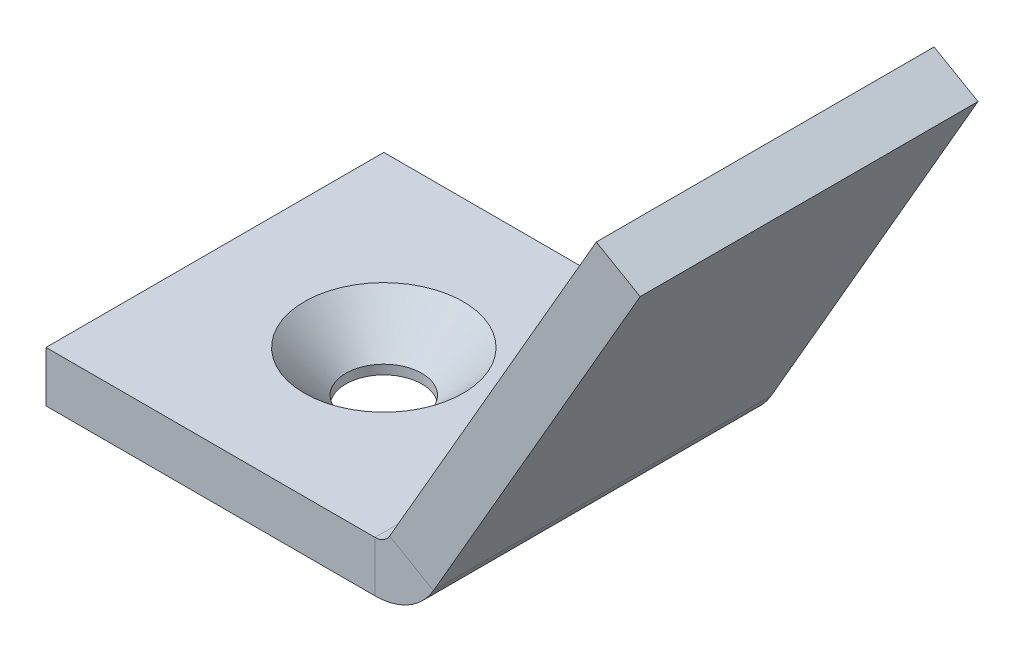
SolidWorks part; units mm, degrees
ref_plane "Front Plane" through (0, 0, 0) normal (0, 0, 1) x (1, 0, 0)
ref_plane "Top Plane" through (0, 0, 0) normal (0, 1, 0) x (1, 0, 0)
ref_plane "Right Plane" through (0, 0, 0) normal (1, 0, 0) x (0, 0, -1)
sketch "Sketch1" plane through (0, 0, 0) normal (0, 1, 0) x (1, 0, 0)
  line L1 (0, 0) -> (45, 0)
  line L2 (0, 0) -> (0, 20)
  line L3 (0, 20) -> (45, 20)
  line L4 (45, 0) -> (45, 20)
  dimension "D1" = 20
  dimension "D2" = 45
sheet metal parameters "Sheet-Metal1" thickness 3 parameters "D1"=1
base flange "Base-Flange1" sketch "Sketch1" thickness 3 reverse thickness direction yes parameters "D1"=1
sketch "Sketch3" plane through (0, 3, 0) normal (0, 1, 0) x (1, 0, 0)
  line L0 (45, 10) -> (0, 10) construction
  line L1 (45, 0) -> (45, 20) construction
  line L2 (0, 20) -> (0, 0) construction
  point P6 (10, 10)
  dimension "D1" = 10
hole_wizard "CSK for M4 Countersunk Flat Head Screw1" positions "3DSketch1" profile "Sketch4" countersink size "M4" standard "ISO"
sketch3d "3DSketch1"
  point P0 (10, 3, -10)
sketch "Sketch4" plane through (10, 3, -10) normal (1, 0, 0) x (0, 0, 1)
  line L0 (0, 0) -> (0, 3)
  line L1 (0, 3) -> (2.25, 3)
  line L2 (2.25, 3) -> (2.25, 2.45)
  line L3 (2.25, 2.45) -> (4.7, 0)
  line L5 (4.7, 0) -> (0, 0)
  line L6 (-2.25, 2.45) -> (-4.7, 0) construction
  line L11 (0, -6.35) -> (0, 107.95) construction
  dimension "Thru Hole Dia." = 4.5
  dimension "Thru Hole Depth" = 3
  dimension "Near C'Sink Dia." = 9.4
  dimension "Near C'Sink Angle" = 90
sketch "Sketch5" plane through (0, 3, 0) normal (0, 1, 0) x (1, 0, 0)
  line L0 (20, 20) -> (20, 0)
  line L3 (45, 20) -> (0, 20) construction
  line L4 (0, 0) -> (45, 0) construction
  circle A1 centre (10, 10) radius 4.7 construction
  dimension "D1" = 10
sketched bend "Sketched Bend1" parameters "D1"=1
bend "SketchBend1" bend radius 1 bend angle 60 parameters "D5"=1
flat pattern "Flat-Pattern1"
sketch "Bend-Lines1" plane through (0, 0, 0) normal (0, 1, 0) x (-1, 0, 0)
bend of the flat pattern "Flatten-<SketchBend1>1"
